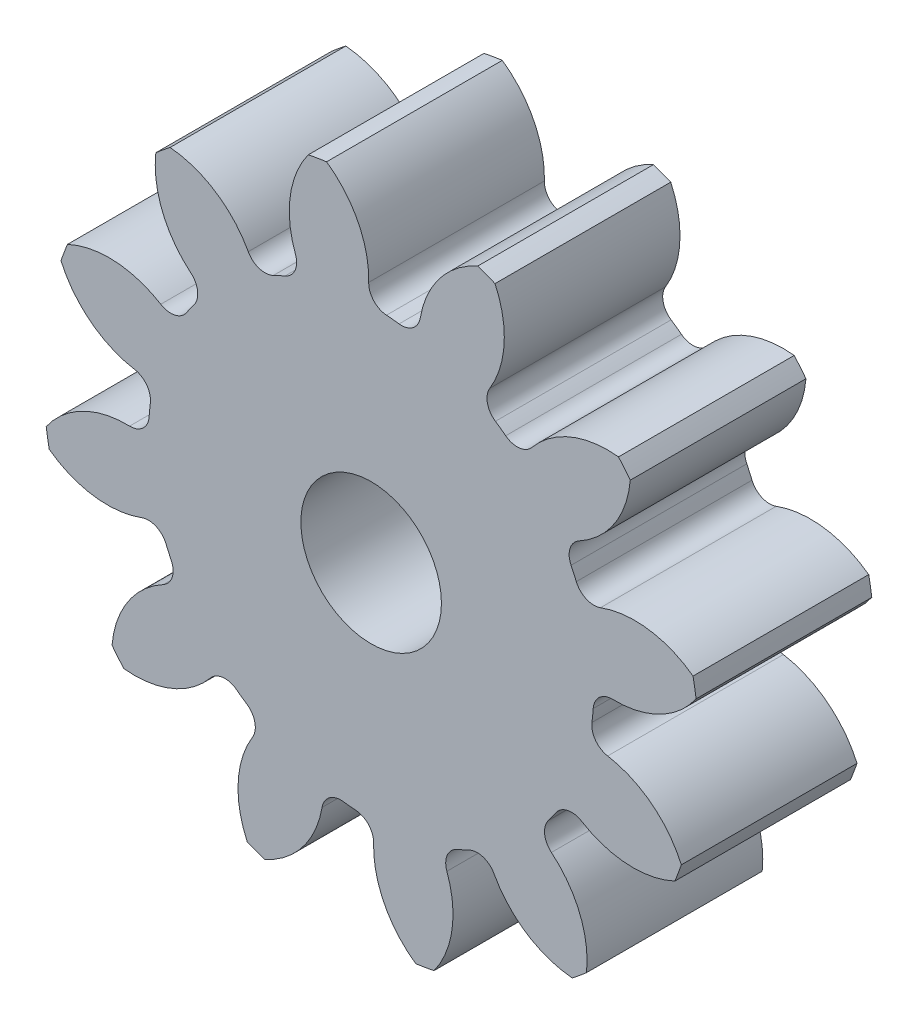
SolidWorks part; units mm, degrees
ref_plane "Front" through (0, 0, 0) normal (0, 0, 1) x (1, 0, 0)
ref_plane "Top" through (0, 0, 0) normal (0, 1, 0) x (1, 0, 0)
ref_plane "Right" through (0, 0, 0) normal (1, 0, 0) x (0, 0, -1)
sketch "Sketch3" plane through (0, 0, 0) normal (0, 0, 1) x (1, 0, 0)
  circle A0 centre (0, 0) radius 237.0667
  dimension "od" = 474.1333
extrude "gearBody" add sketch "Sketch3" along normal blind 127
sketch "Sketch2" plane through (0, 0, 0) normal (0, 0, 1) x (1, 0, 0)
  line L0 (0, 0) -> (176.4107, 73.0717) construction
  line L1 (225.719, -80.7153) -> (0, 0) construction
  line L2 (0, 0) -> (36.3143, 0) construction
  line L3 (203.0821, 6.9199) -> (197.9111, -46.0592) construction
  line L5 (200.4966, -19.5696) -> (0, 0) construction
  line L7 (0, 0) -> (190.9455, 0) construction
  arc A0 (190.9181, 3.2365) -> (186.6889, -40.0931) centre (0, 0) ccw construction
  arc A1 (234.8689, 32.2054) -> (224.2085, -77.014) centre (0, 0) ccw construction
  arc A2 (203.0821, 6.9199) -> (197.9111, -46.0592) centre (0, 0) ccw construction
  arc A3 (159.596, -20.1793) -> (160.4858, -11.0625) centre (0, 0) ccw
  arc A4 (225.719, -80.7153) -> (170.9518, -35.4956) centre (158.9513, -105.8049) ccw
  arc A5 (225.719, -80.7153) -> (237.0667, 35.5448) centre (0, 0) ccw
  arc A6 (237.0667, 35.5448) -> (174.589, 1.7688) centre (176.4107, 73.0717) cw
  arc A7 (160.4858, -11.0625) -> (174.589, 1.7688) centre (174.2369, -12.0104) cw
  arc A8 (170.9518, -35.4956) -> (159.596, -20.1793) centre (173.2708, -21.9083) cw
  point P6 (237.0667, 35.5448)
  point P22 (225.719, -80.7153)
  dimension "baseDia" = 381.8911
  dimension "od" = 474.1333
  dimension "pd" = 406.4
  dimension "rd" = 321.7333
  dimension "rFillet" = 13.7837
  dimension "pointX" = 237.0667
  dimension "pointY" = 35.5448
  dimension "CTT" = 52.9791
  dimension "flankCenterAngle" = 22.5
extrude "toothCut" cut sketch "Sketch2" along normal through all
pattern_circular "CirPattern1" count 12 over 360 about axis through (0, 0, 0) along (0, 0, 1) of "toothCut"
sketch "hub1Dia" plane through (0, 0, 0) normal (0, 0, -1) x (-1, 0, 0)
  circle A0 centre (0, 0) radius 12.7
  dimension "hub1Dia" = 25.4
sketch "hub2Dia" plane through (0, 0, 127) normal (0, 0, 1) x (1, 0, 0)
  circle A0 centre (0, 0) radius 12.7
  dimension "hub2dia" = 25.4
sketch "boreDia" plane through (0, 0, 0) normal (0, 0, 1) x (1, 0, 0)
  circle A0 centre (0, 0) radius 50.8
  dimension "boreDia" = 101.6
extrude "bore" cut sketch "boreDia" against normal mid plane 25400
